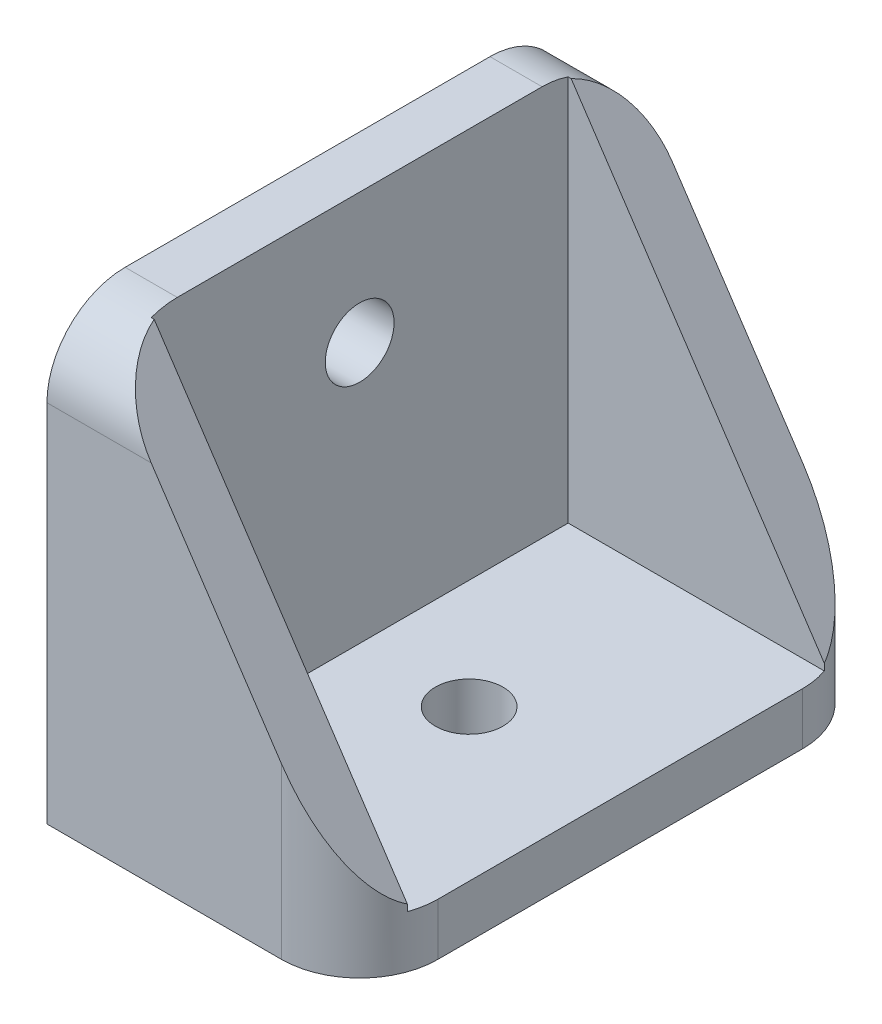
SolidWorks part; units mm, degrees
ref_plane "Front Plane" through (0, 0, 0) normal (0, 0, 1) x (1, 0, 0)
ref_plane "Top Plane" through (0, 0, 0) normal (0, 1, 0) x (1, 0, 0)
ref_plane "Right Plane" through (0, 0, 0) normal (1, 0, 0) x (0, 0, -1)
sketch "Sketch1" plane through (0, 0, 0) normal (0, 1, 0) x (1, 0, 0)
  line L0 (0, 12.7) -> (7.874, 12.7) construction
  line L1 (0, 0) -> (15.24, 0)
  line L2 (0, 0) -> (0, 25.4)
  line L3 (0, 25.4) -> (15.24, 25.4)
  line L4 (15.24, 0) -> (15.24, 25.4)
  circle A0 centre (7.874, 12.7) radius 1.651
  circle A1 centre (7.874, 12.7) radius 3.9624 construction
extrude "Boss-Extrude1" add sketch "Sketch1" along normal blind 2.54
sketch "Sketch2" plane through (0, 0, 0) normal (0, 1, 0) x (1, 0, 0)
  line L0 (0, 0) -> (15.24, 0) construction
  line L1 (0, 25.4) -> (2.54, 25.4)
  line L2 (0, 25.4) -> (0, 0)
  line L3 (0, 0) -> (2.54, 0)
  line L4 (2.54, 25.4) -> (2.54, 0)
extrude "Boss-Extrude2" add sketch "Sketch2" along normal blind 21.59
sketch "Sketch5" plane through (0, 0, -25.4) normal (0, 0, -1) x (-1, 0, 0)
  line L0 (-15.24, 2.54) -> (-2.54, 21.59)
rib "Rib9" sketch "Sketch5" sketch "Sketch5" thickness 2.54 extrusion direction parallel to sketch draft on no parameters "D1"=2.54
sketch "Sketch6" plane through (0, 0, 0) normal (0, 0, 1) x (1, 0, 0)
  line L0 (2.54, 21.59) -> (15.24, 2.54)
  line L1 (2.54, 21.59) -> (2.54, 2.54)
  line L2 (2.54, 2.54) -> (15.24, 2.54)
extrude "Boss-Extrude3" add sketch "Sketch6" against normal blind 2.54
fillet "Fillet1" radius 3.81 1 edges at (1.27, 21.59, 0)
fillet "Fillet2" radius 3.81 1 edges at (1.27, 21.59, -25.4)
fillet "Fillet3" radius 3.81 1 edges at (15.24, 1.27, -25.4)
fillet "Fillet4" radius 3.81 1 edges at (15.24, 1.27, 0)
sketch "Sketch7" plane through (2.54, 0, 0) normal (1, 0, 0) x (0, 0, -1)
  line L0 (12.7, 21.59) -> (12.7, 15.24) construction
  line L1 (3.81, 21.59) -> (21.59, 21.59) construction
  circle A0 centre (12.7, 15.24) radius 1.6764
extrude "Cut-Extrude1" cut sketch "Sketch7" against normal through all
